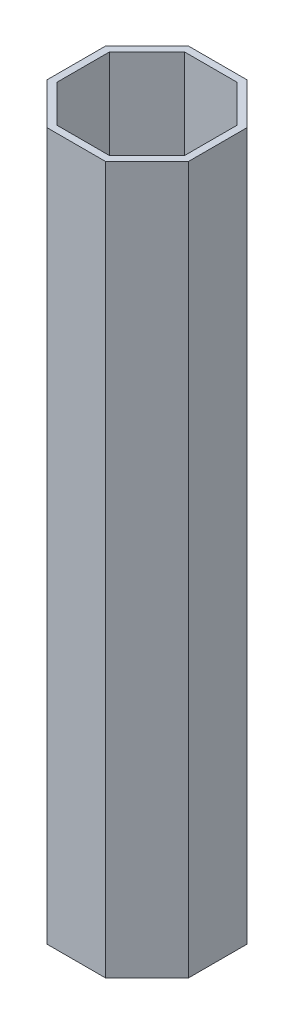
SolidWorks part; units mm, degrees
ref_plane "Plan de face" through (0, 0, 0) normal (0, 0, 1) x (1, 0, 0)
ref_plane "Plan de dessus" through (0, 0, 0) normal (0, 1, 0) x (1, 0, 0)
ref_plane "Plan de droite" through (0, 0, 0) normal (1, 0, 0) x (0, 0, -1)
sketch "Esquisse1" plane through (0, 0, 0) normal (0, 1, 0) x (1, 0, 0)
  line L1 (41.4214, -100) -> (100, -41.4214)
  line L2 (100, -41.4214) -> (100, 41.4214)
  line L3 (100, 41.4214) -> (41.4214, 100)
  line L4 (41.4214, 100) -> (-41.4214, 100)
  line L5 (-41.4214, 100) -> (-100, 41.4214)
  line L6 (-100, 41.4214) -> (-100, -41.4214)
  line L7 (-100, -41.4214) -> (-41.4214, -100)
  line L8 (-41.4214, -100) -> (41.4214, -100)
  circle A0 centre (0, 0) radius 100 construction
  dimension "D1" = 200
extrude "Forme extérieure" add sketch "Esquisse1" along normal blind 1000
shell "Trou" thickness 10
